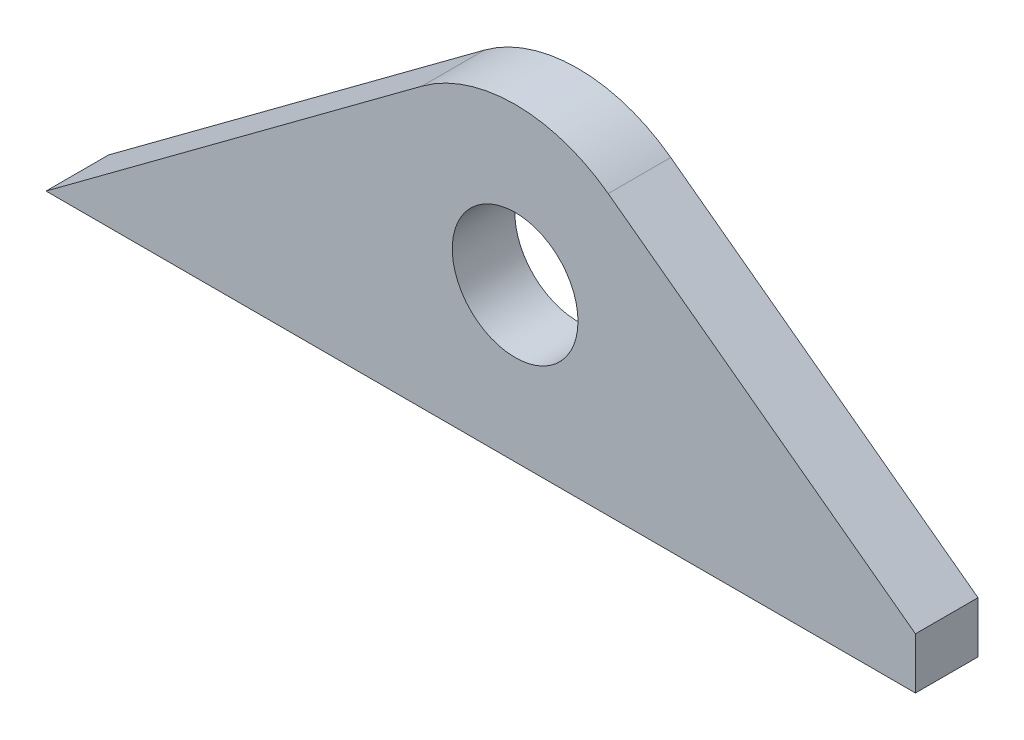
SolidWorks part; units mm, degrees
ref_plane "Plan de face" through (0, 0, 0) normal (0, 0, 1) x (1, 0, 0)
ref_plane "Plan de dessus" through (0, 0, 0) normal (0, 1, 0) x (1, 0, 0)
ref_plane "Plan de droite" through (0, 0, 0) normal (1, 0, 0) x (0, 0, -1)
sketch "Esquisse1" plane through (0, 0, 0) normal (0, 0, 1) x (1, 0, 0)
  line L0 (64, -24.5) -> (-75, -24.5)
  line L1 (-75, -24.5) -> (-14.8928, 20.08)
  line L2 (14.8818, 20.0881) -> (64, -16.3)
  line L3 (64, -16.3) -> (64, -24.5)
  circle A0 centre (0, 0) radius 10.05
  arc A1 (-14.8928, 20.08) -> (14.8818, 20.0881) centre (0, 0) cw
  dimension "D2" = 20.1
  dimension "D3" = 25
  dimension "D1" = 139
  dimension "D4" = 8.2
  dimension "D5" = 24.5
  dimension "D6" = 64
extrude "Extrusion1" add sketch "Esquisse1" along normal blind 10
